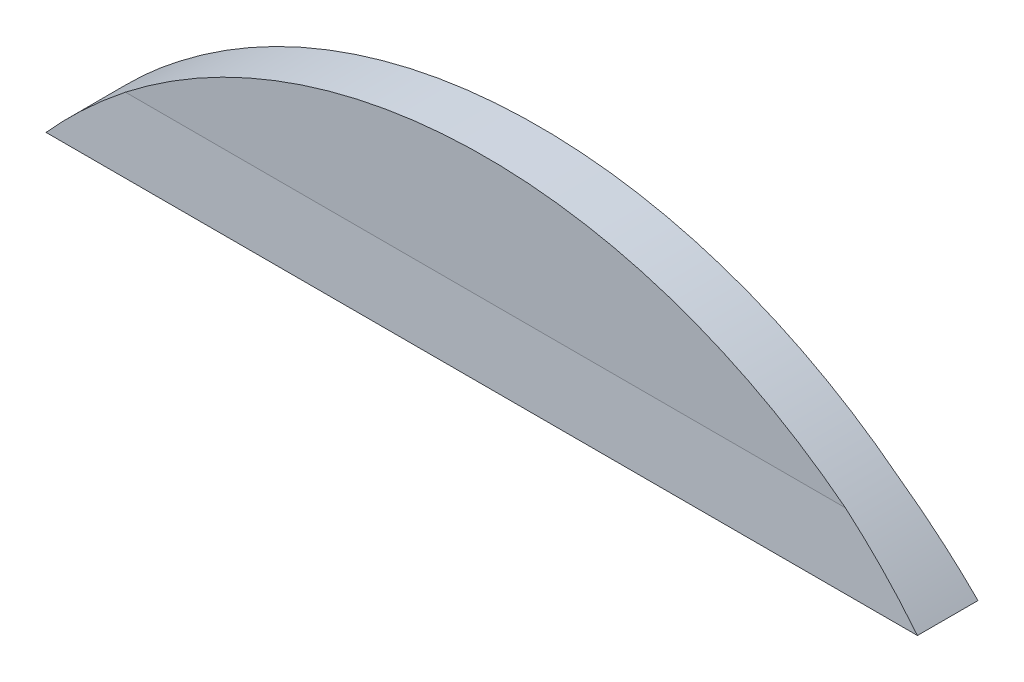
SolidWorks part; units mm, degrees
ref_plane "Vorderansicht" through (0, 0, 0) normal (0, 0, 1) x (1, 0, 0)
ref_plane "Draufsicht" through (0, 0, 0) normal (0, 1, 0) x (1, 0, 0)
ref_plane "Seitenansicht" through (0, 0, 0) normal (1, 0, 0) x (0, 0, -1)
sketch "Sketch1" plane through (0, 0, 0) normal (0, 0, 1) x (1, 0, 0)
  line L0 (-24.5967, 22) -> (24.5967, 22)
  arc A0 (24.5967, 22) -> (-24.5967, 22) centre (0, 0) ccw
  dimension "D1" = 33
  dimension "D2" = 22
extrude "Extrude1" add sketch "Sketch1" along normal mid plane 3
ref_plane "Plane1" through (0, 33, 0) normal (0, 1, 0) x (1, 0, 0)
ref_plane "Plane2" through (0, 26, 0) normal (0, 1, 0) x (-1, 0, 0)
sketch "Sketch2" plane through (0, 0, 0) normal (0, 0, 1) x (1, 0, 0)
  line L0 (1.7556, 26) -> (-1.7556, 26) construction
  line L1 (-20.3224, 26) -> (20.3224, 26)
  arc A0 (24.5967, 22) -> (-24.5967, 22) centre (0, 0) ccw construction
sketch "Sketch3" plane through (0, 0, 0) normal (0, 0, 1) x (1, 0, 0)
  line L0 (-20.3224, 26) -> (20.3224, 26) construction
  line L1 (-20.3224, 26) -> (20.3224, 26)
draft "Draft1" type of draft neutral plane draft angle 3 neutral plane "Plane2" faces to draft 2 parameters "D1"=3
